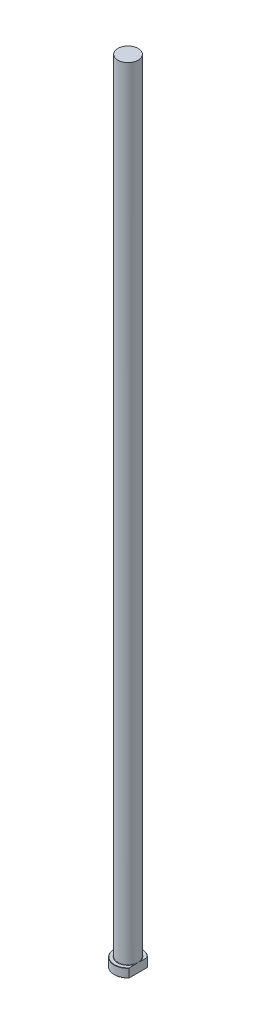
SolidWorks part; units mm, degrees
ref_plane "Front Plane" through (0, 0, 0) normal (0, 0, 1) x (1, 0, 0)
ref_plane "Top Plane" through (0, 0, 0) normal (0, 1, 0) x (1, 0, 0)
ref_plane "Right Plane" through (0, 0, 0) normal (1, 0, 0) x (0, 0, -1)
sketch "Sketch1" plane through (0, 0, 0) normal (0, 0, 1) x (1, 0, 0)
  line L0 (0, 259.9588) -> (0, -15.1925) construction
  line L1 (0, 0) -> (-11, 0)
  line L2 (-11, 0) -> (-11, 7)
  line L3 (-11, 7) -> (-8.1, 7)
  line L4 (-8.1, 7) -> (-8.1, 630)
  line L5 (-8.1, 630) -> (0, 630)
  line L6 (0, 630) -> (0, 0)
  dimension "L" = 630
  dimension "H" = 22
  dimension "T" = 7
  dimension "D" = 16.2
revolve "Revolve1" add sketch "Sketch1" angle 360 about L0
chamfer "Chamfer1" distance 0.2 angle 45 2 edges at (0, 7, 11) (0, 0, 11)
fillet "Fillet1" radius 0.3 1 edges at (0, 7, 8.1)
sketch "Sketch2" plane through (0, 0, 0) normal (0, 1, 0) x (1, 0, 0)
  line L0 (8.1, 7.4424) -> (8.1, -7.4424)
  circle A0 centre (0, 0) radius 11 construction
  arc A1 (8.1, -7.4424) -> (8.1, 7.4424) centre (0, 0) ccw
  circle A2 centre (0, 0) radius 8.1 construction
extrude "KEY" cut sketch "Sketch2" along normal through all
